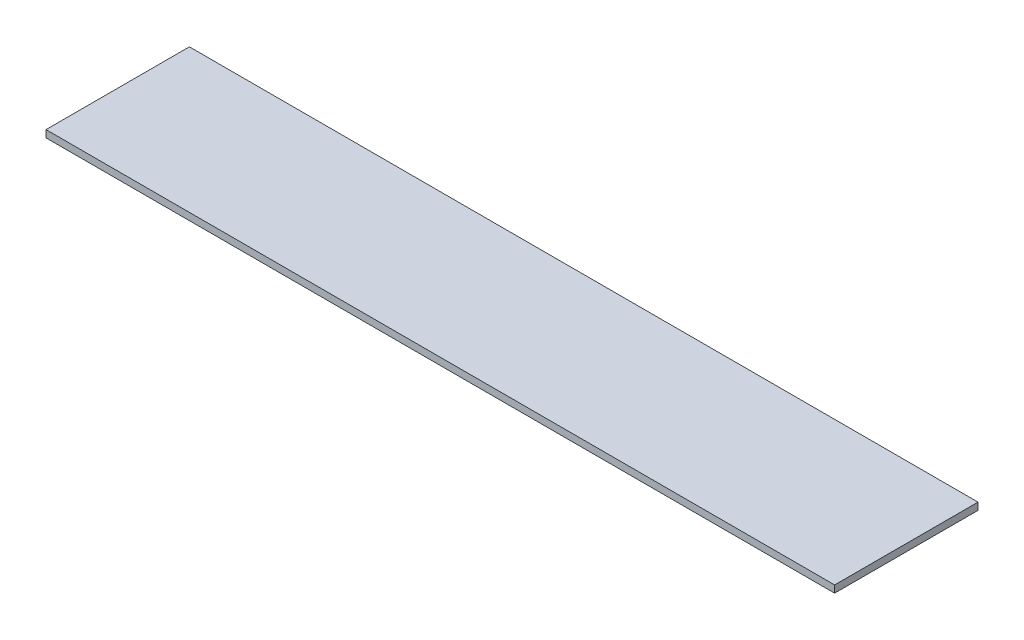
SolidWorks part; units mm, degrees
ref_plane "Plan de face" through (0, 0, 0) normal (0, 0, 1) x (1, 0, 0)
ref_plane "Plan de dessus" through (0, 0, 0) normal (0, 1, 0) x (1, 0, 0)
ref_plane "Plan de droite" through (0, 0, 0) normal (1, 0, 0) x (0, 0, -1)
sketch "Esquisse1" plane through (0, 0, 0) normal (0, 1, 0) x (1, 0, 0)
  line L0 (-275, -50) -> (275, 50) construction
  line L1 (-275, 50) -> (275, 50)
  line L2 (-275, 50) -> (-275, -50)
  line L3 (-275, -50) -> (275, -50)
  line L4 (275, 50) -> (275, -50)
  dimension "D1" = 100
  dimension "D2" = 550
extrude "Boss.-Extru.1" add sketch "Esquisse1" against normal blind 5
